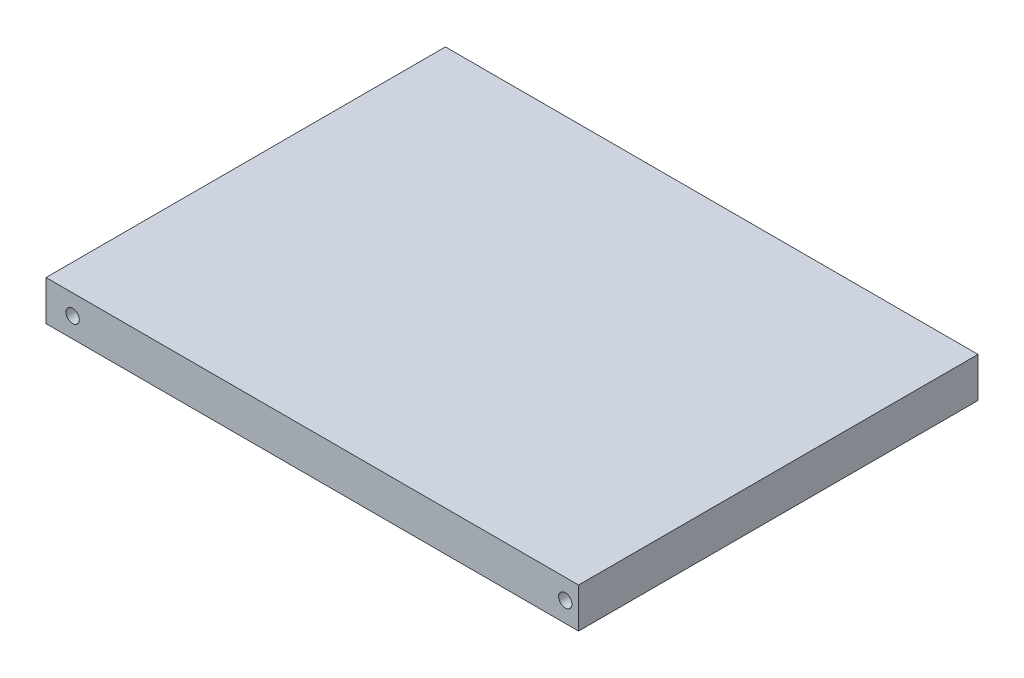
SolidWorks part; units mm, degrees
ref_plane "Plan de face" through (0, 0, 0) normal (0, 0, 1) x (1, 0, 0)
ref_plane "Plan de dessus" through (0, 0, 0) normal (0, 1, 0) x (1, 0, 0)
ref_plane "Plan de droite" through (0, 0, 0) normal (1, 0, 0) x (0, 0, -1)
sketch "Esquisse1" plane through (0, 0, 0) normal (0, 0, 1) x (1, 0, 0)
  line L1 (0, 0) -> (400, 0)
  line L2 (0, 0) -> (0, 30)
  line L3 (0, 30) -> (400, 30)
  line L4 (400, 0) -> (400, 30)
  circle A0 centre (20, 15) radius 5
  circle A1 centre (390, 15) radius 5
  dimension "D3" = 20
  dimension "D4" = 10
  dimension "D5" = 15
  dimension "D6" = 370
  dimension "D1" = 30
  dimension "D2" = 400
extrude "Extrusion1" add sketch "Esquisse1" along normal mid plane 300
sketch "Esquisse2" plane through (0, 0, 0) normal (0, 0, 1) x (1, 0, 0)
  point P0 (140, 15)
  dimension "D1" = 120
  dimension "D2" = 0
